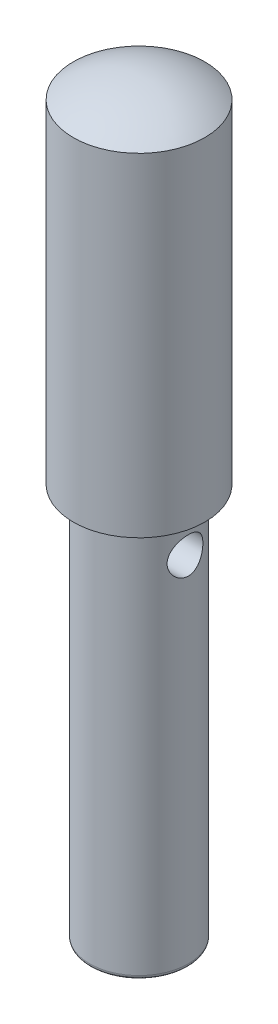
SolidWorks part; units mm, degrees
ref_plane "FRONT" through (0, 0, 0) normal (0, 0, 1) x (1, 0, 0)
ref_plane "TOP" through (0, 0, 0) normal (0, 1, 0) x (1, 0, 0)
ref_plane "RIGHT" through (0, 0, 0) normal (1, 0, 0) x (0, 0, -1)
sketch "Sketch1" plane through (0, 0, 0) normal (0, 0, 1) x (1, 0, 0)
  line L1 (-8.7198, 0) -> (0, 0)
  line L2 (-12.6886, 140.4661) -> (0, 140.4661) construction
  line L3 (0, 0) -> (0, 144.4625)
  line L5 (0, 0) -> (0, 151.3712) construction
  line L6 (-12.6886, 76.2) -> (-10.0216, 76.2)
  line L7 (-9.5136, 75.692) -> (-9.5136, 0.7938)
  line L8 (0, -50) -> (0, 50) construction
  line L9 (50, 0) -> (-50, 0) construction
  line L10 (-12.6886, 140.4661) -> (-12.6886, 76.2)
  arc A0 (-8.7198, 0) -> (-9.5136, 0.7938) centre (-8.7198, 0.7938) cw
  arc A1 (0, 144.4625) -> (-12.6886, 140.4661) centre (0, 122.3213) ccw
  arc A2 (-9.5136, 75.692) -> (-10.0216, 76.2) centre (-10.0216, 75.692) ccw
  dimension "D1" = 0.7937
  dimension "D5" = 22.1412
  dimension "D7" = 0.508
  dimension "D2" = 19.0271
  dimension "D4" = 76.2
  dimension "D6" = 144.4625
  dimension "D8" = 25.3771
revolve "Base-Revolve" add sketch "Sketch1" angle 360 about L5
ref_plane "CamFollowerHolePlane" through (-9.5136, 0, 0) normal (1, 0, 0) x (0, 0, -1)
sketch "Sketch2" plane through (-9.5136, 0, 0) normal (1, 0, 0) x (0, 0, -1)
  line L0 (-12.6886, 76.2) -> (12.6886, 76.2) construction
  line L1 (0, 0) -> (0, 151.3712) construction
  circle A0 centre (0, 69.0563) radius 3.9878
  dimension "D1" = 7.9756
  dimension "D2" = 7.1438
extrude "Cut-Extrude1" cut sketch "Sketch2" along normal blind 7.9375
sketch "Sketch3" plane through (-1.5761, 96.5364, -5.214) normal (-1, 0, 0) x (0, 0, 1)
  point P0 (5.214, -27.4801)
sketch "Sketch4" plane through (-4.7511, 69.0563, 0) normal (0, 1, 0) x (0, 0, 1)
  line L0 (0, 0) -> (0, 11.1504)
  line L1 (0, 11.1504) -> (2.7051, 9.525)
  line L2 (2.7051, 9.525) -> (2.7051, 0)
  line L4 (2.7051, 0) -> (0, 0)
  line L6 (0, 11.1504) -> (-2.7051, 9.525) construction
  line L7 (0, -4.2442) -> (0, 117.3081) construction
  dimension "Diameter" = 5.4102
  dimension "Depth" = 9.525
  dimension "Drill Angle" = 118
sketch "Sketch5" plane through (-1.5761, 99.8185, -5.1382) normal (-1, 0, 0) x (0, 0, 1)
  point P0 (5.1382, -30.7622)
sketch "Sketch6" plane through (-1.5761, 69.0563, 0) normal (0, 1, 0) x (0, 0, 1)
  line L0 (0, 0) -> (0, 14.7756)
  line L1 (0, 14.7756) -> (3.4544, 12.7)
  line L2 (3.4544, 12.7) -> (3.4544, 0)
  line L4 (3.4544, 0) -> (0, 0)
  line L6 (0, 14.7756) -> (-3.4544, 12.7) construction
  line L7 (0, -4.2442) -> (0, 117.3081) construction
  dimension "Diameter" = 6.9088
  dimension "Depth" = 12.7
  dimension "Drill Angle" = 118
hole_wizard "TAP.3125-241" positions "Sketch5" profile "Sketch6" legacy
